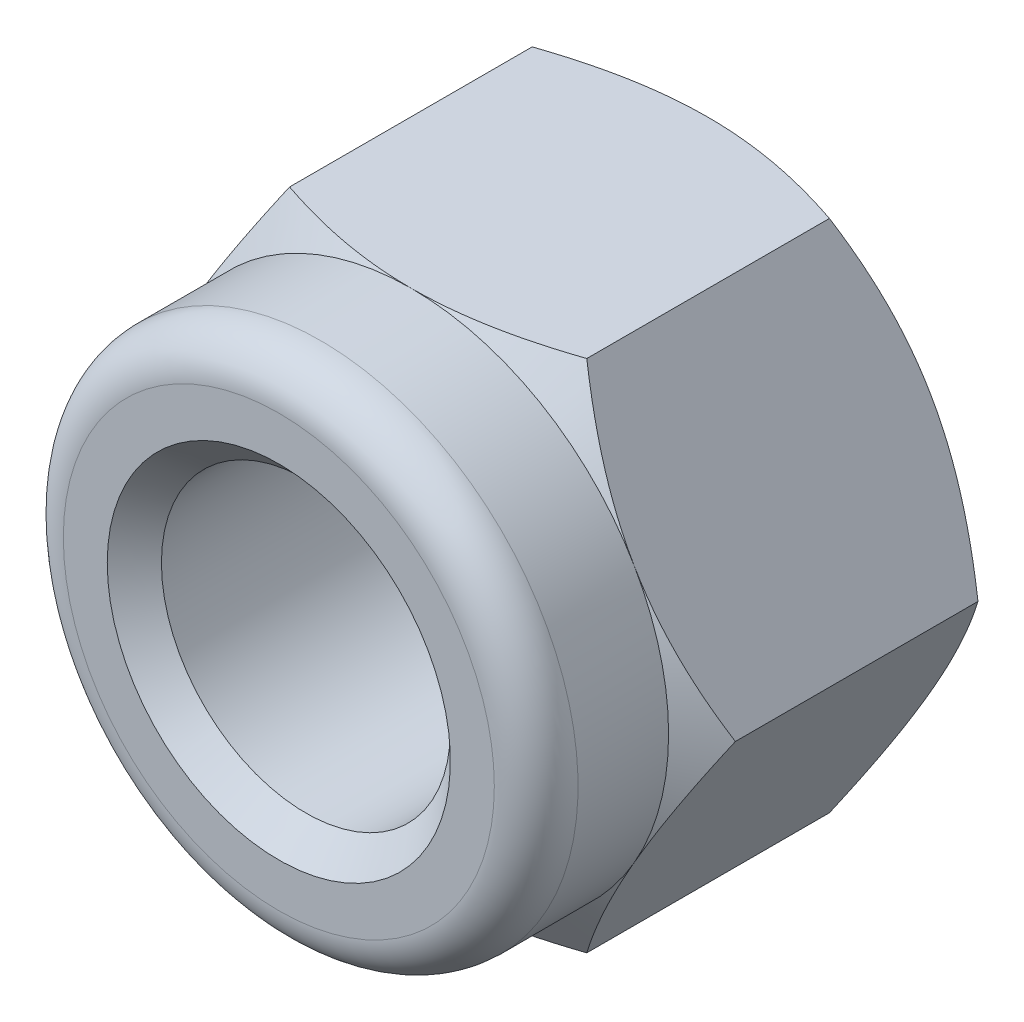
SolidWorks part; units mm, degrees
ref_plane "Plan1" through (0, 0, 0) normal (0, 0, 1) x (1, 0, 0)
ref_plane "Plan2" through (0, 0, 0) normal (0, 1, 0) x (1, 0, 0)
ref_plane "Plan3" through (0, 0, 0) normal (1, 0, 0) x (0, 0, -1)
sketch "Sketch1" plane through (0, 0, 0) normal (0, 0, 1) x (1, 0, 0)
  line L0 (-10.3923, 0) -> (10.3923, 0) construction
  line L1 (0, 9) -> (0, -9) construction
  line L2 (-5.1962, 9) -> (5.1962, 9)
  line L3 (5.1962, 9) -> (10.3923, 0)
  line L4 (10.3923, 0) -> (5.1962, -9)
  line L5 (5.1962, -9) -> (-5.1962, -9)
  line L6 (-5.1962, -9) -> (-10.3923, 0)
  line L7 (-10.3923, 0) -> (-5.1962, 9)
  dimension "D1" = 120
  dimension "S" = 18
extrude "Base-Extrude" add sketch "Sketch1" along normal blind 10.37
sketch "Sketch2" plane through (0, 0, 0) normal (0, 1, 0) x (1, 0, 0)
  line L0 (-10.3923, 0) -> (-10.3923, -0.9427)
  line L1 (-10.3923, -10.37) -> (-10.3923, 0) construction
  line L2 (-10.3923, -0.9427) -> (-9, 0)
  line L4 (-5.1962, 0) -> (-10.3923, 0) construction
  line L5 (0, 0) -> (0, -10.37) construction
  line L6 (5.1962, -10.37) -> (-5.1962, -10.37) construction
  line L7 (5.1962, 0) -> (-5.1962, 0) construction
  line L8 (-9, 0) -> (-10.3923, 0)
  line L9 (-10.3923, -10.37) -> (-10.3923, -9.4273)
  line L10 (-10.3923, -9.4273) -> (-9, -10.37)
  line L11 (-5.1962, -10.37) -> (-10.3923, -10.37) construction
  line L12 (-9, -10.37) -> (-10.3923, -10.37)
  line L13 (0, 0) -> (0, -1.75) construction
  dimension "D1" = 0.9427
  dimension "P" = 1.75
revolve "Cut-Revolve1" cut sketch "Sketch2" angle 360 about L5
sketch "Sketch3" plane through (0, 0, 0) normal (0, 0, -1) x (-1, 0, 0)
  circle A0 centre (0, 0) radius 9
  arc A1 (-7.7942, 4.5) -> (-7.7942, -4.5) centre (0, 0) ccw construction
extrude "Boss-Extrude1" add sketch "Sketch3" against normal blind 15
fillet "Fillet1" radius 1.4641 1 edges at (-9, 0, 15)
other "Hole1"
sketch "Sketch4" plane through (0, 0, 0) normal (0, 0, -1) x (-1, 0, 0)
  circle A0 centre (0, 0) radius 5.0528
  arc A1 (-7.7942, 4.5) -> (-7.7942, -4.5) centre (0, 0) ccw construction
  dimension "D1" = 10.1056
chamfer "Chamfer1" distance 0.9472 angle 45 2 edges at (-5.0528, 0, 15) (-5.0528, 0, 0)
sketch "Esquisse1" plane through (0, 0, 0) normal (0, 0, 1) x (1, 0, 0)
  circle A0 centre (0, 0) radius 6
  dimension "D1" = 12
extrude "DRW" cut sketch "Esquisse1" along normal through all
equation "\"D1@Sketch2\" = \"M@Base-Extrude\" / 11"
equation "\"D1@Fillet1\" = ((\"S@Sketch1\"*1.1547)-\"D@Cosmetic_Thread1\")/6"
equation "\"D1@Sketch4\" = \"D@Cosmetic_Thread1\"-(1.0825*\"P@Sketch2\")"
equation "\"D1@Chamfer1\" = (\"D@Cosmetic_Thread1\"-\"D1@Sketch4\")/2"
